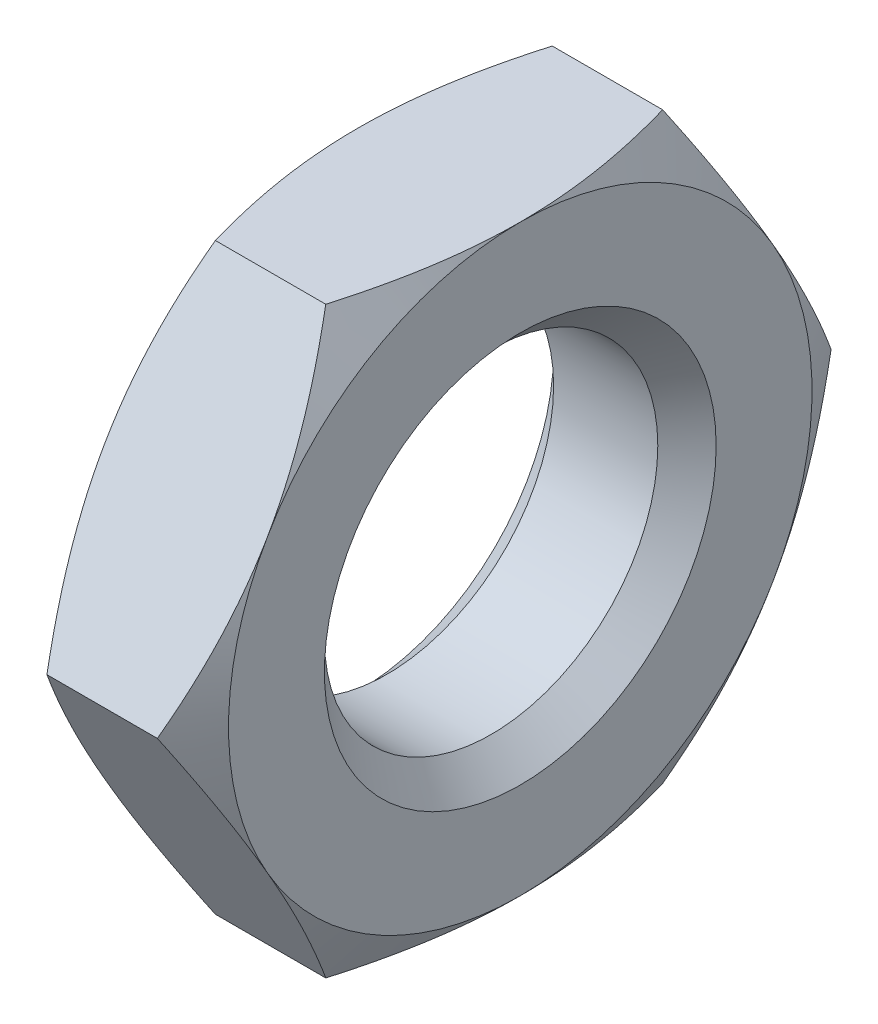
SolidWorks part; units mm, degrees
ref_plane "Front Plane" through (0, 0, 0) normal (0, 0, 1) x (1, 0, 0)
ref_plane "Top Plane" through (0, 0, 0) normal (0, 1, 0) x (1, 0, 0)
ref_plane "Right Plane" through (0, 0, 0) normal (1, 0, 0) x (0, 0, -1)
sketch "Sketch1" plane through (0, 0, 0) normal (1, 0, 0) x (0, 0, -1)
  line L1 (2.0207, 3.5) -> (-2.0207, 3.5)
  line L2 (-2.0207, 3.5) -> (-4.0415, 0)
  line L3 (-4.0415, 0) -> (-2.0207, -3.5)
  line L4 (-2.0207, -3.5) -> (2.0207, -3.5)
  line L5 (2.0207, -3.5) -> (4.0415, 0)
  line L6 (4.0415, 0) -> (2.0207, 3.5)
  circle A0 centre (0, 0) radius 3.5 construction
  circle A1 centre (0, 0) radius 2
extrude "Extrude1" add sketch "Sketch1" along normal blind 1.95
sketch "Sketch2" plane through (0, 0, 0) normal (0, 0, 1) x (1, 0, 0)
  line L0 (1.95, 3.5) -> (1.95, 14)
  line L1 (1.95, 14) -> (0, 14)
  line L2 (0, 14) -> (0, 3.5)
  line L3 (0, 3.5) -> (0.975, 5.1887)
  line L4 (0.975, 5.1887) -> (1.95, 3.5)
revolve "Cut-Revolve1" cut sketch "Sketch2" angle 360 about axis through (1.95, 0, 0) along (-1, 0, 0)
chamfer "Chamfer1" distance 0.35 angle 45 2 edges at (0, 0, -2) (1.95, 0, -2)
equation "\"D2@Sketch2\"=\"D1@Sketch1\"*2"
